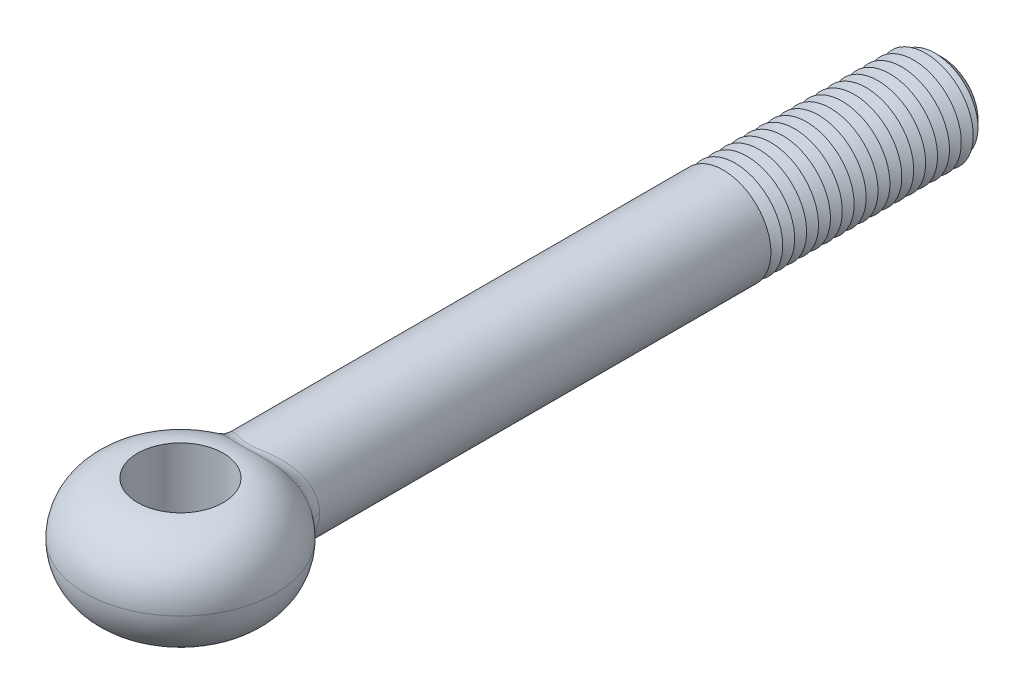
SolidWorks part; units mm, degrees
ref_plane "Front Plane" through (0, 0, 0) normal (0, 0, 1) x (1, 0, 0)
ref_plane "Top Plane" through (0, 0, 0) normal (0, 1, 0) x (1, 0, 0)
ref_plane "Right Plane" through (0, 0, 0) normal (1, 0, 0) x (0, 0, -1)
sketch "Sketch7" plane through (0, 0, 0) normal (0, 1, 0) x (1, 0, 0)
  circle A0 centre (0, 0) radius 20
  dimension "D1" = 40
extrude "Boss-Extrude3" add sketch "Sketch7" along normal mid plane 22
sketch "Sketch8" plane through (0, 0, 0) normal (0, 0, 1) x (1, 0, 0)
  circle A0 centre (0, 0) radius 10
  dimension "D1" = 20
extrude "Boss-Extrude4" add sketch "Sketch8" against normal blind 160
fillet "Fillet5" radius 11 2 edges at (0, -11, 20) (0, 11, 20)
fillet "Fillet6" radius 3.5 2 edges at (0.8553, -9.9634, -13.6349) (-0.8553, 9.9634, -13.6349)
chamfer "Chamfer1" distance 2.5 angle 45 1 edges at (10, 0, -160)
sketch "Sketch10" plane through (0, 0, 0) normal (0, 1, 0) x (1, 0, 0)
  line L0 (0, 28.1405) -> (0, -7.9233) construction
sketch "Sketch11" plane through (0, 0, 0) normal (0, 1, 0) x (1, 0, 0)
  line L0 (-10, 114) -> (-7.8349, 115.25)
  line L1 (-10, 157.5) -> (-10, 19.2354) construction
  line L2 (-7.8349, 115.25) -> (-10, 116.5)
  line L3 (-10, 116.5) -> (-10, 114)
  line L4 (7.5, 160) -> (-7.5, 160) construction
  dimension "D1" = 2.5
  dimension "D2" = 46
revolve "Cut-Revolve1" cut sketch "Sketch11" angle 360 about L0
pattern_linear "LPattern1" count 18 spacing 2.5 along (0, 0, -1) of "Cut-Revolve1"
sketch "Sketch12" plane through (0, 0, 0) normal (0, 1, 0) x (1, 0, 0)
  circle A0 centre (0, 0) radius 9
  dimension "D1" = 18
extrude "Cut-Extrude1" cut sketch "Sketch12" against normal mid plane 22
